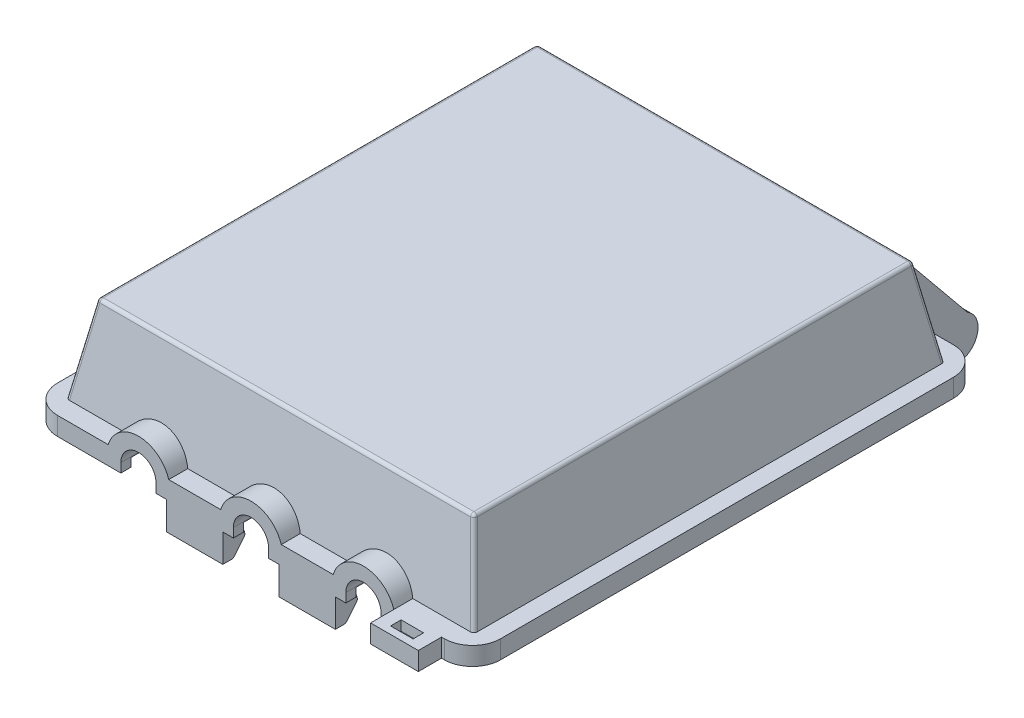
SolidWorks part; units mm, degrees
ref_plane "Front Plane" through (0, 0, 0) normal (0, 0, 1) x (1, 0, 0)
ref_plane "Top Plane" through (0, 0, 0) normal (0, 1, 0) x (1, 0, 0)
ref_plane "Right Plane" through (0, 0, 0) normal (1, 0, 0) x (0, 0, -1)
sketch "Sketch1" plane through (0, 0, 0) normal (0, 1, 0) x (1, 0, 0)
  line L1 (-40.005, -45.974) -> (40.005, -45.974)
  line L2 (-40.005, -45.974) -> (-40.005, 45.974)
  line L3 (-40.005, 45.974) -> (40.005, 45.974)
  line L4 (40.005, -45.974) -> (40.005, 45.974)
  line L5 (-40.005, -45.974) -> (40.005, 45.974) construction
  line L6 (-40.005, 45.974) -> (40.005, -45.974) construction
  point P0 (0, 0)
extrude "Boss-Extrude1" add sketch "Sketch1" along normal blind 19.05
sketch "Sketch2" plane through (0, 19.05, 0) normal (0, 1, 0) x (1, 0, 0)
  line L1 (-36.83, -42.545) -> (36.83, -42.545)
  line L2 (-36.83, -42.545) -> (-36.83, 42.545)
  line L3 (-36.83, 42.545) -> (36.83, 42.545)
  line L4 (36.83, -42.545) -> (36.83, 42.545)
  line L5 (-36.83, -42.545) -> (36.83, 42.545) construction
  line L6 (-36.83, 42.545) -> (36.83, -42.545) construction
  point P0 (0, 0)
extrude "Cut-Extrude1" cut sketch "Sketch2" against normal blind 15.748 flip side to cut
sketch "Sketch3" plane through (0, 0, -42.545) normal (0, 0, -1) x (-1, 0, 0)
  line L5 (-31.115, 15.24) -> (-31.115, -4.826)
  line L10 (-31.115, -4.826) -> (-28.702, -4.826)
  line L11 (-28.702, -4.826) -> (-28.702, 15.24)
  line L12 (-28.702, 15.24) -> (-31.115, 15.24)
  line L13 (31.115, 15.24) -> (31.115, -4.826)
  line L14 (31.115, -4.826) -> (28.702, -4.826)
  line L15 (28.702, -4.826) -> (28.702, 15.24)
  line L16 (28.702, 15.24) -> (31.115, 15.24)
  line L19 (-12.7, 15.24) -> (-12.7, -4.826)
  line L20 (-12.7, -4.826) -> (-10.287, -4.826)
  line L21 (-10.287, -4.826) -> (-10.287, 15.24)
  line L22 (-10.287, 15.24) -> (-12.7, 15.24)
  line L23 (12.7, 15.24) -> (12.7, -4.826)
  line L24 (12.7, -4.826) -> (10.287, -4.826)
  line L25 (10.287, -4.826) -> (10.287, 15.24)
  line L26 (10.287, 15.24) -> (12.7, 15.24)
extrude "Boss-Extrude2" add sketch "Sketch3" along normal blind 11.684
sketch "Sketch5" plane through (31.115, 0, 0) normal (1, 0, 0) x (0, 0, -1)
  line L0 (45.974, 0) -> (46.609, 0) construction
  line L1 (46.609, 0) -> (50.419, 0) construction
  line L2 (42.545, 0) -> (42.545, -4.826)
  line L3 (42.545, -4.826) -> (54.229, -4.826)
  line L4 (54.229, -4.826) -> (54.229, 0)
  line L5 (42.545, 0) -> (46.609, 0)
  circle A1 centre (50.419, 0) radius 3.81 construction
  arc A2 (46.609, 0) -> (54.229, 0) centre (50.419, 0) ccw
extrude "Cut-Extrude2" cut sketch "Sketch5" against normal through all
sketch "Sketch6" plane through (31.115, 0, 0) normal (1, 0, 0) x (0, 0, -1)
  line L1 (52.3198, 3.302) -> (42.545, 15.24)
  line L2 (42.545, 15.24) -> (54.229, 15.24)
  line L3 (54.229, 15.24) -> (54.229, 0)
  arc A0 (54.229, 0) -> (52.3198, 3.302) centre (50.419, 0) ccw
extrude "Cut-Extrude3" cut sketch "Sketch6" against normal through all
sketch "Sketch7" plane through (31.115, 0, 0) normal (1, 0, 0) x (0, 0, -1)
  circle A0 centre (50.419, 0) radius 1.651
extrude "Boss-Extrude3" add sketch "Sketch7" against normal blind 20.828
sketch "Sketch9" plane through (-31.115, 0, 0) normal (-1, 0, 0) x (0, 0, 1)
  circle A0 centre (-50.419, 0) radius 1.651
extrude "Boss-Extrude4" add sketch "Sketch9" against normal blind 20.828
sketch "Sketch10" plane through (0, 0, 42.545) normal (0, 0, 1) x (1, 0, 0)
  line L0 (0, 1.651) -> (0, 7.366) construction
  line L2 (-5.715, 1.651) -> (5.715, 1.651)
  line L3 (0, 1.651) -> (20.32, 1.651) construction
  line L5 (0, 1.651) -> (-20.32, 1.651) construction
  line L6 (-26.035, 1.651) -> (-14.605, 1.651)
  line L7 (14.605, 1.651) -> (26.035, 1.651)
  arc A0 (5.715, 1.651) -> (-5.715, 1.651) centre (0, 1.651) ccw
  arc A1 (-14.605, 1.651) -> (-26.035, 1.651) centre (-20.32, 1.651) ccw
  arc A2 (26.035, 1.651) -> (14.605, 1.651) centre (20.32, 1.651) ccw
extrude "Boss-Extrude5" add sketch "Sketch10" along normal blind 3.429
sketch "Sketch12" plane through (0, 0, 45.974) normal (0, 0, 1) x (1, 0, 0)
  line L0 (0, 7.366) -> (0, 4.826) construction
  line L1 (-23.495, 1.651) -> (-23.495, 0)
  line L2 (-40.005, 0) -> (40.005, 0) construction
  line L3 (-23.495, 0) -> (-17.145, 0)
  line L4 (-17.145, 0) -> (-17.145, 1.651)
  line L5 (-3.175, 1.651) -> (-3.175, 0)
  line L6 (-3.175, 0) -> (3.175, 0)
  line L7 (3.175, 0) -> (3.175, 1.651)
  line L8 (17.145, 1.651) -> (17.145, 0)
  line L9 (17.145, 0) -> (23.495, 0)
  line L10 (23.495, 0) -> (23.495, 1.651)
  arc A0 (5.4713, 3.302) -> (-5.4713, 3.302) centre (0, 1.651) ccw construction
  arc A1 (3.175, 1.651) -> (-3.175, 1.651) centre (0, 1.651) ccw
  arc A2 (23.495, 1.651) -> (17.145, 1.651) centre (20.32, 1.651) ccw
  arc A3 (-17.145, 1.651) -> (-23.495, 1.651) centre (-20.32, 1.651) ccw
extrude "Cut-Extrude4" cut sketch "Sketch12" against normal blind 12.7
sketch "Sketch13" plane through (0, 3.302, 0) normal (0, 1, 0) x (1, 0, 0)
  line L0 (25.7913, -45.974) -> (25.7913, -50.165)
  line L1 (25.7913, -50.165) -> (34.417, -50.165)
  line L2 (34.417, -50.165) -> (34.417, -45.974)
  line L3 (25.7913, -45.974) -> (40.005, -45.974) construction
  line L4 (34.417, -45.974) -> (25.7913, -45.974)
extrude "Boss-Extrude6" add sketch "Sketch13" against normal blind 3.302
sketch "Sketch15" plane through (0, 3.302, 0) normal (0, 1, 0) x (1, 0, 0)
  line L7 (28.0722, -46.9265) -> (32.1362, -46.9265)
  line L12 (28.0722, -46.9265) -> (28.0722, -48.8315)
  line L13 (28.0722, -48.8315) -> (32.1362, -48.8315)
  line L14 (32.1362, -46.9265) -> (32.1362, -48.8315)
  line L15 (28.0722, -46.9265) -> (32.1362, -48.8315) construction
  line L16 (28.0722, -48.8315) -> (32.1362, -46.9265) construction
extrude "Cut-Extrude5" cut sketch "Sketch15" against normal through all
sketch "Sketch16" plane through (0, 0, 0) normal (0, -1, 0) x (1, 0, 0)
  line L0 (-40.005, 0) -> (-31.369, 0) construction
  line L1 (-34.417, -40.132) -> (34.417, -40.132)
  line L2 (-34.417, -40.132) -> (-34.417, 40.132)
  line L3 (-34.417, 40.132) -> (34.417, 40.132)
  line L4 (34.417, -40.132) -> (34.417, 40.132)
  line L5 (-34.417, -40.132) -> (34.417, 40.132) construction
  line L6 (-34.417, 40.132) -> (34.417, -40.132) construction
  line L7 (-40.005, -45.974) -> (-40.005, 45.974) construction
  point P0 (0, 0)
extrude "Cut-Extrude7" cut sketch "Sketch16" against normal blind 17.018 draft 10.25
sketch "Sketch17" plane through (0, 0, 0) normal (0, -1, 0) x (1, 0, 0)
  line L1 (-38.227, -44.1071) -> (38.227, -44.1071)
  line L2 (-38.227, -44.1071) -> (-38.227, 44.1071)
  line L3 (-38.227, 44.1071) -> (38.227, 44.1071)
  line L4 (38.227, -44.1071) -> (38.227, 44.1071)
  line L5 (-38.227, -44.1071) -> (38.227, 44.1071) construction
  line L6 (-38.227, 44.1071) -> (38.227, -44.1071) construction
  point P0 (0, 0)
extrude "Cut-Extrude8" cut sketch "Sketch17" against normal blind 1.524
draft "Draft2" type of draft neutral plane draft angle 10.25 faces to draft 4 parameters "D1"=10.25
fillet "Fillet1" radius 0.635 8 edges at (-35.4061, 11.176, -41.1211) (35.4061, 11.176, -41.1211) (-35.4061, 11.176, 41.1211) (35.4061, 11.176, 41.1211) (0, 19.05, -39.6973) (33.9823, 19.05, 0) (0, 19.05, 39.6973) (-33.9823, 19.05, 0)
fillet "Fillet2" radius 5.08 4 edges at (-40.005, 1.651, 45.974) (-40.005, 1.651, -45.974) (40.005, 1.651, -45.974) (40.005, 1.651, 45.974)
fillet "Fillet3" radius 3.556 4 edges at (38.227, 0.762, -44.1071) (38.227, 0.762, 44.1071) (-38.227, 0.762, -44.1071) (-38.227, 0.762, 44.1071)
sketch "Sketch21" plane through (0, 0, 0) normal (0, -1, 0) x (1, 0, 0)
  line L6 (26.6803, 44.1071) -> (26.6803, 49.276)
  line L7 (34.671, 44.1071) -> (23.495, 44.1071) construction
  line L8 (26.6803, 49.276) -> (33.528, 49.276)
  line L9 (33.528, 49.276) -> (33.528, 44.1071)
  line L10 (34.671, 44.1071) -> (23.495, 44.1071) construction
  line L11 (33.528, 44.1071) -> (26.6803, 44.1071)
extrude "Cut-Extrude9" cut sketch "Sketch21" against normal blind 1.524
fillet "Fillet4" radius 0.635 16 edges at (31.115, 18.5853, -39.7786) (12.7, 18.5853, -39.7786) (-10.287, 18.5853, -39.7786) (-28.702, 18.5853, -39.7786) (28.702, 18.5853, -39.7786) (10.287, 18.5853, -39.7786) (-12.7, 18.5853, -39.7786) (-31.115, 18.5853, -39.7786) (31.115, 10.915, -41.1683) (12.7, 10.915, -41.1683) (-10.287, 10.915, -41.1683) (-28.702, 10.915, -41.1683) (28.702, 10.915, -41.1683) (10.287, 10.915, -41.1683) (-12.7, 10.915, -41.1683) (-31.115, 10.915, -41.1683)
sketch "Sketch22" plane through (0, 0, 0) normal (0, -1, 0) x (1, 0, 0)
  line L4 (-17.145, 45.974) -> (-3.175, 45.974) construction
  line L6 (-15.24, 41.9818) -> (-5.08, 41.9818)
  line L7 (-15.24, 41.9818) -> (-15.24, 45.974)
  line L8 (-15.24, 45.974) -> (-5.08, 45.974)
  line L9 (-5.08, 41.9818) -> (-5.08, 45.974)
  line L10 (-15.24, 41.9818) -> (-5.08, 45.974) construction
  line L11 (-15.24, 45.974) -> (-5.08, 41.9818) construction
  line L13 (3.175, 45.974) -> (17.145, 45.974) construction
  line L15 (5.08, 41.9818) -> (15.24, 41.9818)
  line L16 (5.08, 41.9818) -> (5.08, 45.974)
  line L17 (5.08, 45.974) -> (15.24, 45.974)
  line L18 (15.24, 41.9818) -> (15.24, 45.974)
  line L19 (5.08, 41.9818) -> (15.24, 45.974) construction
  line L20 (5.08, 45.974) -> (15.24, 41.9818) construction
  point P10 (-10.16, 43.9779)
  point P17 (10.16, 43.9779)
extrude "Boss-Extrude7" add sketch "Sketch22" along normal blind 5.08
sketch "Sketch26" plane through (-15.24, 0, 0) normal (-1, 0, 0) x (0, 0, 1)
  line L0 (41.9818, 0) -> (44.1242, 0)
  line L1 (40.894, 0) -> (45.974, 0) construction
  line L2 (41.9818, -5.08) -> (41.9818, 0) construction
  line L4 (41.9818, 0) -> (41.9818, -2.54)
  line L5 (44.1242, 0) -> (44.1242, -0.127)
  line L6 (44.1242, -0.127) -> (43.7769, -0.127)
  arc A1 (43.7769, -0.127) -> (41.9818, -2.54) centre (44.5217, -2.5553) ccw
extrude "Cut-Extrude11" cut sketch "Sketch26" against normal through all
sketch "Sketch27" plane through (-15.24, 0, 0) normal (-1, 0, 0) x (0, 0, 1)
  line L0 (41.9818, -5.08) -> (41.9818, -2.54)
  line L1 (45.974, -5.08) -> (41.9818, -5.08) construction
  line L4 (41.9818, -5.08) -> (44.1071, -5.08)
  line L5 (41.9818, -2.54) -> (44.1071, -5.08)
extrude "Cut-Extrude12" cut sketch "Sketch27" against normal through all
fillet "Fillet7" radius 0.635 4 edges at (10.16, -5.08, 44.1071) (-10.16, -5.08, 44.1071) (-10.16, -2.54, 41.9818) (10.16, -2.54, 41.9818)
